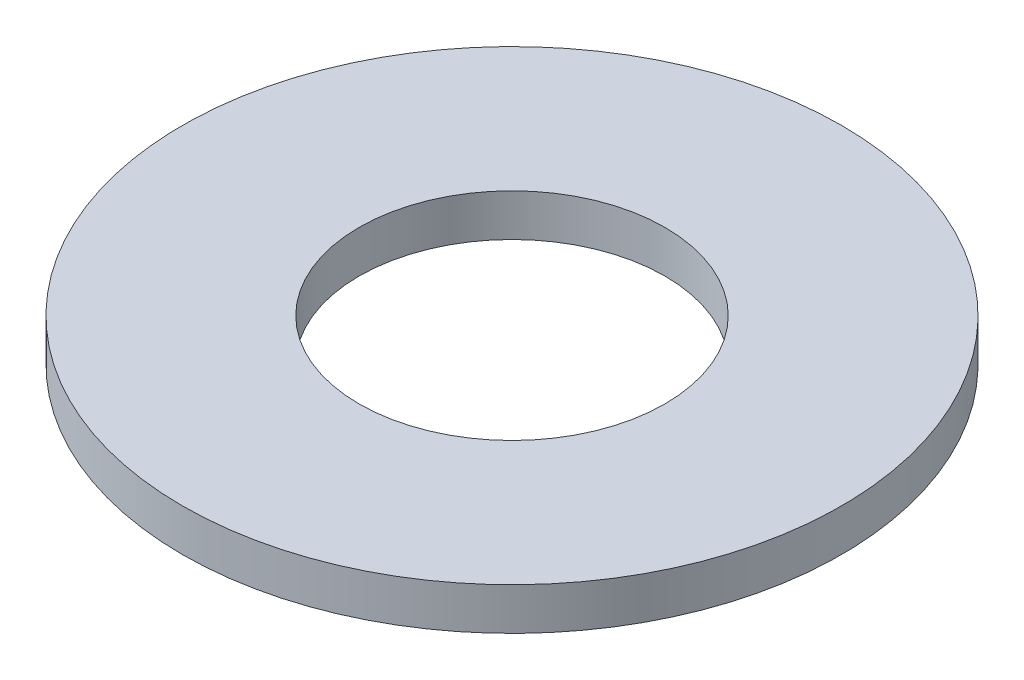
SolidWorks part; units mm, degrees
ref_plane "Front Plane" through (0, 0, 0) normal (0, 0, 1) x (1, 0, 0)
ref_plane "Top Plane" through (0, 0, 0) normal (0, 1, 0) x (1, 0, 0)
ref_plane "Right Plane" through (0, 0, 0) normal (1, 0, 0) x (0, 0, -1)
sketch "Sketch1" plane through (0, 0, 0) normal (0, 1, 0) x (1, 0, 0)
  circle A0 centre (0, 0) radius 4.7625
  dimension "OD" = 9.525
extrude "Boss-Extrude1" add sketch "Sketch1" along normal blind 0.6096
sketch "Sketch5" plane through (0, 0.6096, 0) normal (0, 1, 0) x (-1, 0, 0)
  circle A0 centre (0, 0) radius 2.2098
  dimension "ID" = 4.4196
extrude "Cut-Extrude1" cut sketch "Sketch5" against normal through all
